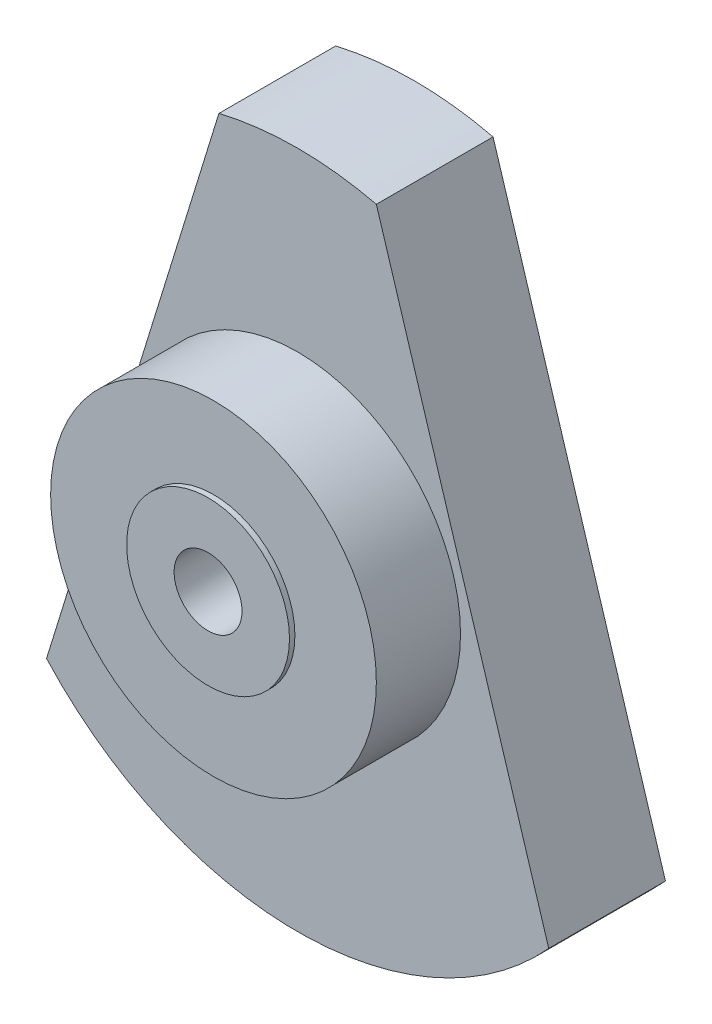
SolidWorks part; units mm, degrees
ref_plane "Front Plane" through (0, 0, 0) normal (0, 0, 1) x (1, 0, 0)
ref_plane "Top Plane" through (0, 0, 0) normal (0, 1, 0) x (1, 0, 0)
ref_plane "Right Plane" through (0, 0, 0) normal (1, 0, 0) x (0, 0, -1)
sketch "Sketch1" plane through (0, 0, 0) normal (0, 0, 1) x (1, 0, 0)
  line L0 (-9.25, -8.4076) -> (9.25, -8.4076) construction
  line L1 (-2.9, 12.1589) -> (2.9, 12.1589) construction
  line L2 (-2.9, 12.1589) -> (-9.25, -8.4076)
  line L3 (2.9, 12.1589) -> (9.25, -8.4076)
  arc A0 (-9.25, -8.4076) -> (9.25, -8.4076) centre (0, 0) ccw
  arc A1 (2.9, 12.1589) -> (-2.9, 12.1589) centre (0, 0) ccw
  dimension "D1" = 25
  dimension "D2" = 18.5
  dimension "D3" = 5.8
extrude "Boss-Extrude1" add sketch "Sketch1" against normal blind 4.3
sketch "Sketch2" plane through (0, 0, 0) normal (0, 0, 1) x (1, 0, 0)
  circle A0 centre (0, 0) radius 6
  dimension "D1" = 12
extrude "Boss-Extrude2" add sketch "Sketch2" along normal blind 3.1
sketch "Sketch3" plane through (0, 0, 3.1) normal (0, 0, 1) x (1, 0, 0)
  circle A0 centre (0, 0) radius 3
  dimension "D1" = 6
extrude "Boss-Extrude3" add sketch "Sketch3" along normal blind 0.2
hole_wizard "M3x0.5 Tapped Hole1" positions "Sketch5" profile "Sketch4" tap size "M3x0.5" standard "ANSI Metric"
sketch "Sketch5" plane through (0, 0, 3.3) normal (0, 0, 1) x (1, 0, 0)
  point P0 (0, 0)
sketch "Sketch4" plane through (0, 0, 3.3) normal (1, 0, 0) x (0, -1, 0)
  line L0 (0, 0) -> (0, 6.7511)
  line L1 (0, 6.7511) -> (1.25, 6)
  line L2 (1.25, 6) -> (1.25, 0)
  line L5 (1.25, 0) -> (0, 0)
  line L10 (0, 6.7511) -> (-1.25, 6) construction
  line L11 (0, -6.35) -> (0, 107.95) construction
  dimension "Tap Drill Dia." = 2.5
  dimension "Tap Drill Depth" = 6
  dimension "Drill Angle" = 118
hole_wizard "Ø2.0mm Press Dowel Hole1" positions "Sketch7" profile "Sketch6" hole size "Ø2.0" standard "ANSI Metric"
sketch "Sketch7" plane through (0, 0, -4.3) normal (0, 0, -1) x (-1, 0, 0)
  arc A0 (2.9, 12.1589) -> (-2.9, 12.1589) centre (0, 0) ccw construction
  point P0 (0, 9)
  point P3 (0, 12.5)
  dimension "D1" = 3.5
sketch "Sketch6" plane through (0, 9, -4.3) normal (1, 0, 0) x (0, 1, 0)
  line L0 (0, 0) -> (0, 3.6009)
  line L1 (0, 3.6009) -> (1, 3)
  line L2 (1, 3) -> (1, 0)
  line L5 (1, 0) -> (0, 0)
  line L10 (0, 3.6009) -> (-1, 3) construction
  line L11 (0, -6.35) -> (0, 107.95) construction
  dimension "Hole Dia." = 2
  dimension "Hole Depth" = 3
  dimension "Drill Angle" = 118
